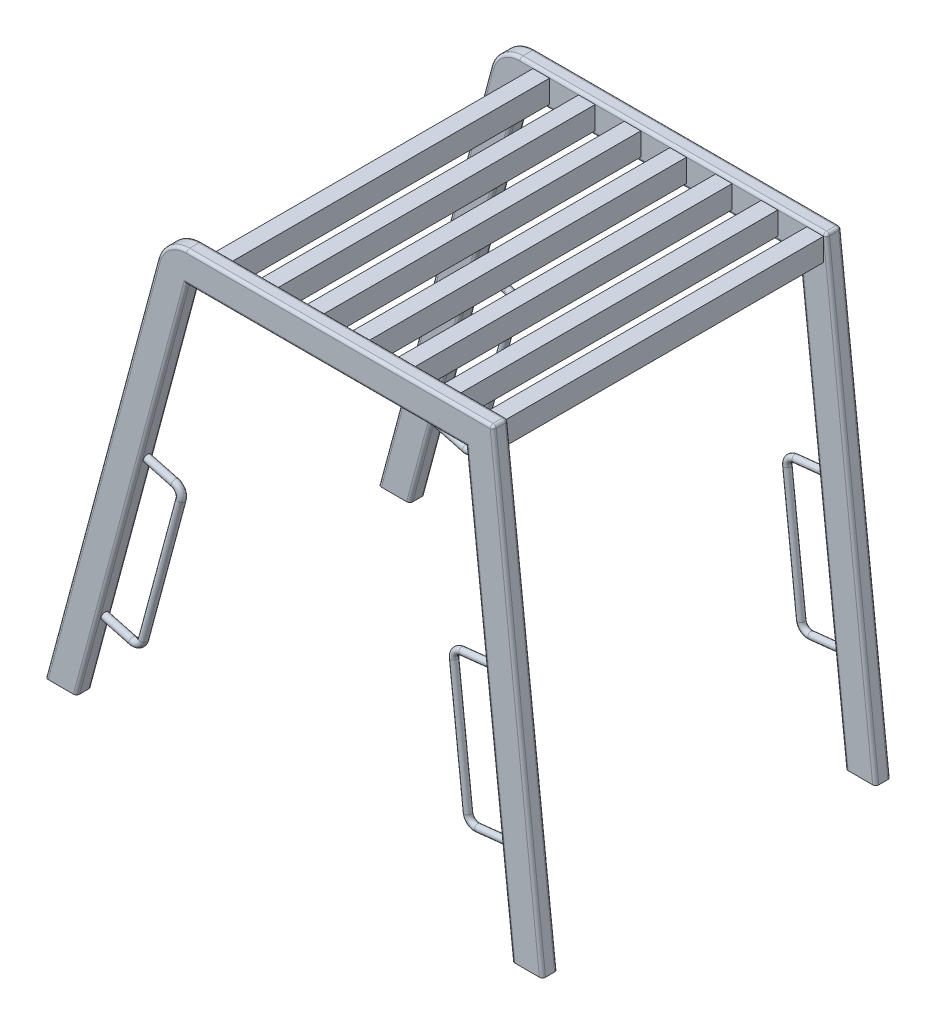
SolidWorks part; units mm, degrees
ref_plane "Front Plane" through (0, 0, 0) normal (0, 0, 1) x (1, 0, 0)
ref_plane "Top Plane" through (0, 0, 0) normal (0, 1, 0) x (1, 0, 0)
ref_plane "Right Plane" through (0, 0, 0) normal (1, 0, 0) x (0, 0, -1)
sketch "Sketch1" plane through (0, 0, 0) normal (0, 0, 1) x (1, 0, 0)
  line L0 (103.5276, 0) -> (465.259, 1350)
  line L1 (0, 0) -> (368.6664, 1375.8819)
  line L2 (465.259, 1450) -> (1471.5769, 1450)
  line L3 (1471.5769, 1450) -> (1630, 0)
  line L4 (1630, 0) -> (1634.3703, -40)
  line L5 (1634.3703, -40) -> (1533.7752, -40)
  line L6 (465.259, 1350) -> (1381.9075, 1350)
  line L7 (1381.9075, 1350) -> (1522.8495, 60)
  line L8 (1522.8495, 60) -> (1522.8495, 60)
  line L9 (1522.8495, 60) -> (1533.7752, -40)
  line L10 (0, 0) -> (103.5276, 0)
  line L11 (0, 0) -> (824.6645, 0) construction
  line L12 (1522.8495, 60) -> (1516.5042, 60) construction
  line L13 (1634.3703, -40) -> (1516.5042, -40) construction
  line L14 (96.5926, -25.8819) -> (465.259, 1350) construction
  line L15 (1634.3703, -40) -> (1946.7453, -40) construction
  arc A0 (368.6664, 1375.8819) -> (465.259, 1450) centre (465.259, 1350) cw
  arc A1 (465.259, 1350) -> (465.259, 1350) centre (465.259, 1350) cw
  dimension "D4" = 100
  dimension "D1" = 1630
  dimension "D2" = 100
  dimension "D3" = 75
  dimension "D5" = 1450
  dimension "D6" = 96.235
extrude "Boss-Extrude1" add sketch "Sketch1" along normal blind 50 contours L0 A1 L6 L7 L9 L5 L4 L3 L2 A0 L1 L10
fillet "Fillet1" radius 10 15 edges at (184.3332, 687.941, 0) (184.3332, 687.941, 50) (404.3829, 1429.3353, 0) (404.3829, 1429.3353, 50) (968.418, 1450, 0) (968.418, 1450, 50) (1471.5769, 1450, 25) (1552.9736, 705, 0) (1552.9736, 705, 50) (1457.8414, 655, 50) (1457.8414, 655, 0) (284.3933, 675, 0) (923.5833, 1350, 0) (923.5833, 1350, 50) (284.3933, 675, 50)
sketch "Sketch6" plane through (96.5926, -25.8819, 0) normal (0.9659, -0.2588, 0) x (0, 0, -1)
  line L0 (-25, 286.214) -> (-10, 286.214) construction
  line L1 (-25, 286.214) -> (-40, 286.214) construction
  line L2 (-40, 1424.4178) -> (-40, 26.7949) construction
  line L3 (-10, 26.7949) -> (-10, 1424.4178) construction
  circle A0 centre (-25, 286.214) radius 12
ref_plane "Plane1" through (0, 0, 25) normal (0, 0, -1) x (-1, 0, 0)
sketch "Sketch7" plane through (0, 0, 25) normal (0, 0, -1) x (-1, 0, 0)
  line L0 (-170.6702, 250.5796) -> (-262.152, 226.0671)
  line L1 (-298.8944, 247.2803) -> (-422.1796, 707.3868)
  line L2 (-400.9664, 744.1291) -> (-299.8292, 771.2288)
  line L4 (-93.1749, 0) -> (-457.5858, 1360) construction
  arc A0 (-422.1796, 707.3868) -> (-400.9664, 744.1291) centre (-393.2018, 715.1514) cw
  arc A1 (-262.152, 226.0671) -> (-298.8944, 247.2803) centre (-269.9166, 255.0449) cw
  dimension "D1" = 30
sweep "Sweep1" add profiles "Sketch6" path "Sketch7"
sketch "Sketch8" plane through (0, 0, 25) normal (0, 0, -1) x (-1, 0, 0)
  line L0 (-1497.8278, 270.97) -> (-1397.7841, 260.0395)
  line L1 (-1364.7033, 286.6037) -> (-1319.0867, 704.1192)
  line L2 (-1345.6509, 737.2) -> (-1447.6429, 748.3434)
  line L3 (-1533.7752, -40) -> (-1381.9075, 1350) construction
  arc A0 (-1397.7841, 260.0395) -> (-1364.7033, 286.6037) centre (-1394.5258, 289.8621) ccw
  arc A1 (-1319.0867, 704.1192) -> (-1345.6509, 737.2) centre (-1348.9092, 707.3775) ccw
  dimension "D1" = 30
  dimension "D2" = 420
sketch "Sketch9" plane through (1511.3635, 165.1275, 0) normal (-0.9941, -0.1086, 0) x (0, 0, 1)
  circle A0 centre (25, 586.6865) radius 11
sweep "Sweep2" add profiles "Sketch9" path "Sketch8"
pattern_linear "LPattern1" count 2 spacing 1095 along (0, 0, 1)
sketch "Sketch10" plane through (0, 0, 50) normal (0, 0, 1) x (1, 0, 0)
  line L0 (1462.61, 1440) -> (465.259, 1440) construction
  line L1 (1408.1587, 1440) -> (1462.61, 1440)
  line L2 (1408.1587, 1440) -> (1408.1587, 1365.482)
  line L3 (1408.1587, 1365.482) -> (1462.61, 1365.482)
  line L4 (1462.61, 1440) -> (1462.61, 1365.482)
extrude "Boss-Extrude2" add sketch "Sketch10" along normal up to next (1045 mm away)
pattern_linear "LPattern8" count 7 spacing 150 along (-1, 0, 0) of "Boss-Extrude2"
ref_plane "Plane2" through (0, 0, 572.5) normal (0, 0, 1) x (1, 0, 0)
